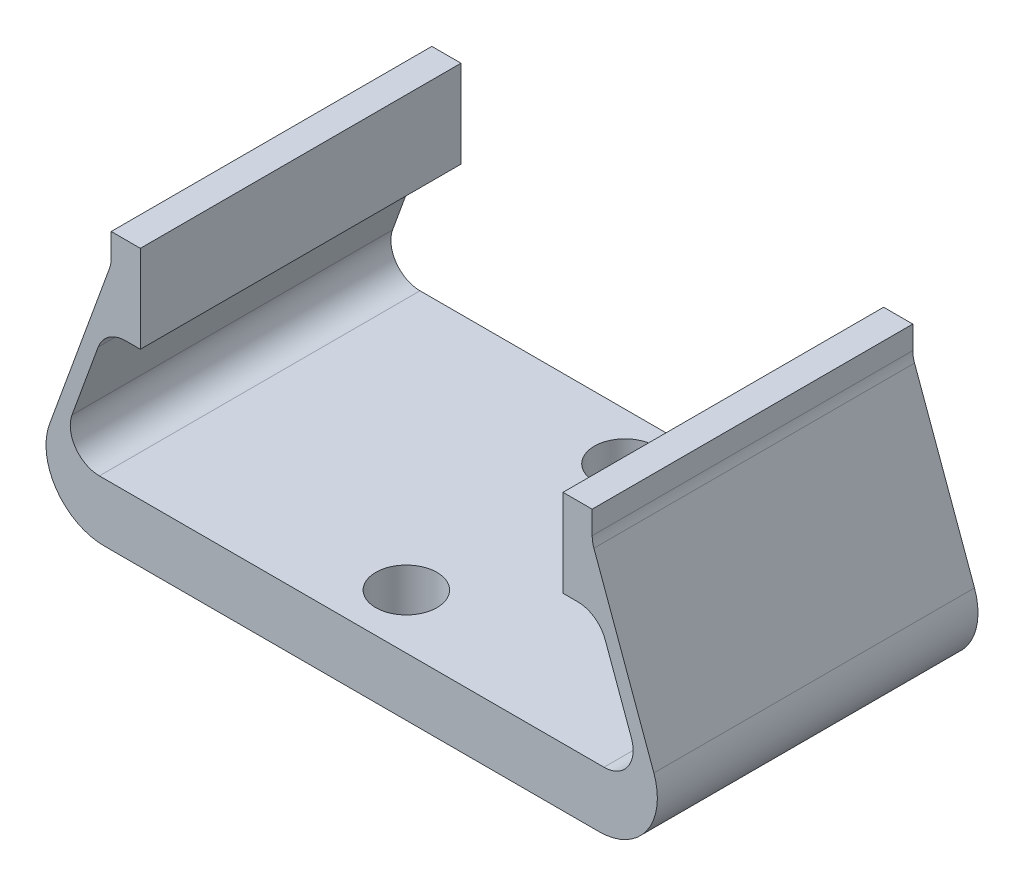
SolidWorks part; units mm, degrees
ref_plane "Front Plane" through (0, 0, 0) normal (0, 0, 1) x (1, 0, 0)
ref_plane "Top Plane" through (0, 0, 0) normal (0, 1, 0) x (1, 0, 0)
ref_plane "Right Plane" through (0, 0, 0) normal (1, 0, 0) x (0, 0, -1)
sketch "Sketch1" plane through (0, 0, 0) normal (0, 0, 1) x (1, 0, 0)
  line L0 (0, 0) -> (22.6875, 0)
  line L1 (22.6875, 0) -> (16.5, 17)
  line L2 (14.5, 12.93) -> (16.9172, 12.93)
  line L3 (16.9172, 12.93) -> (20.1674, 4)
  line L4 (20.1674, 4) -> (0, 4)
  line L5 (0, 4) -> (0, 0)
  line L8 (14.5, 12.93) -> (14.5, 18.93)
  line L9 (14.5, 18.93) -> (16.5, 18.93)
  line L10 (16.5, 18.93) -> (16.5, 17)
  dimension "D1" = 70
  dimension "D2" = 1
  dimension "D4" = 4
  dimension "D5" = 2
  dimension "D6" = 17
  dimension "D7" = 6
  dimension "D8" = 14.5
extrude "Boss-Extrude1" add sketch "Sketch1" along normal blind 22
fillet "Fillet2" radius 4 1 edges at (22.6875, 0, 11)
fillet "Fillet3" radius 2 3 edges at (16.5, 17, 11) (16.9172, 12.93, 11) (20.1674, 4, 11)
mirror "Mirror1" about plane through (0, 0, 0) normal (1, 0, 0) of "Fillet3", "Fillet2", "Boss-Extrude1"
sketch "Sketch2" plane through (0, 0, 0) normal (0, -1, 0) x (1, 0, 0)
  line L0 (0, -55) -> (0, 55) construction
  line L1 (55, 0) -> (-55, 0) construction
  circle A0 centre (0, 3.25) radius 2.1
  circle A1 centre (0, 18.25) radius 2.1
  dimension "D1" = 15
  dimension "D2" = 3.25
extrude "Cut-Extrude1" cut sketch "Sketch2" against normal through all
